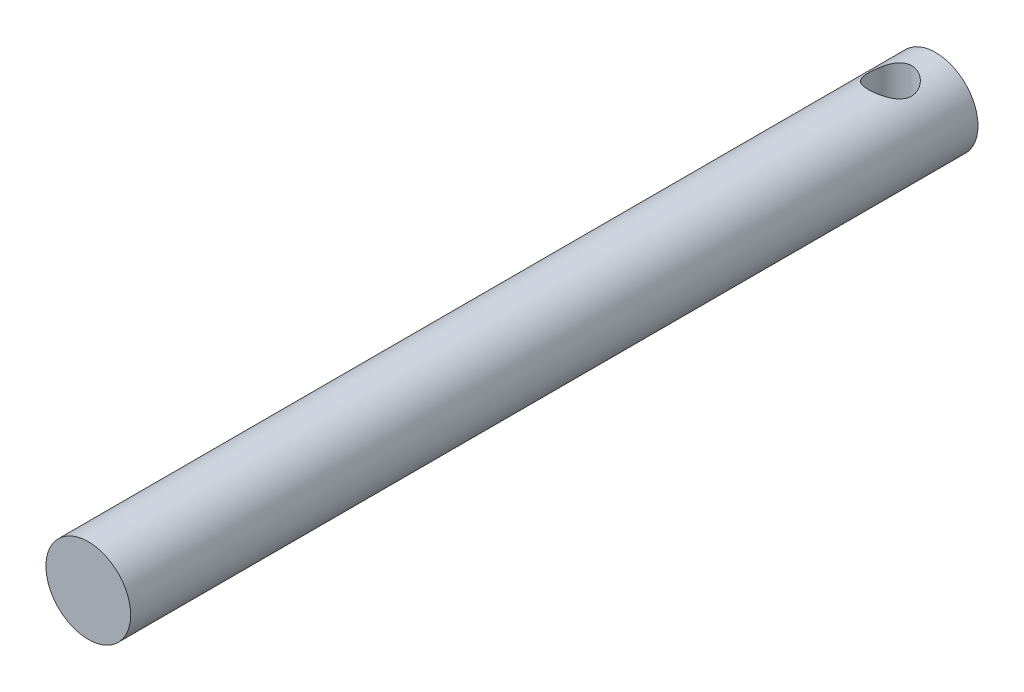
SolidWorks part; units mm, degrees
ref_plane "Front Plane" through (0, 0, 0) normal (0, 0, 1) x (1, 0, 0)
ref_plane "Top Plane" through (0, 0, 0) normal (0, 1, 0) x (1, 0, 0)
ref_plane "Right Plane" through (0, 0, 0) normal (1, 0, 0) x (0, 0, -1)
sketch "Sketch1" plane through (0, 0, 0) normal (0, 0, 1) x (1, 0, 0)
  circle A0 centre (0.4481, 0.5129) radius 10
  dimension "D1" = 20
extrude "Boss-Extrude1" add sketch "Sketch1" along normal blind 200
sketch "Sketch2" plane through (0, 0, 0) normal (0, 1, 0) x (1, 0, 0)
  circle A0 centre (0.2904, -10.5237) radius 5
  point P2 (0.2904, -10.5237)
  dimension "D1" = 10
extrude "Cut-Extrude1" cut sketch "Sketch2" against normal mid plane 200
